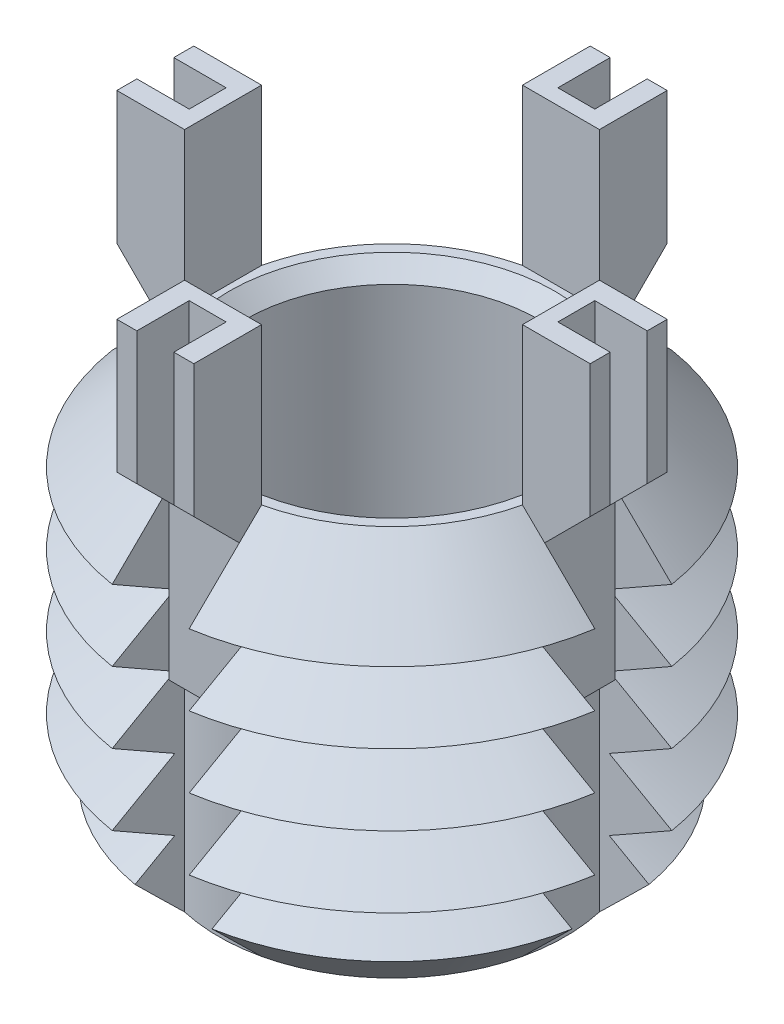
SolidWorks part; units mm, degrees
ref_plane "Front Plane" through (0, 0, 0) normal (0, 0, 1) x (1, 0, 0)
ref_plane "Top Plane" through (0, 0, 0) normal (0, 1, 0) x (1, 0, 0)
ref_plane "Right Plane" through (0, 0, 0) normal (1, 0, 0) x (0, 0, -1)
sketch "Sketch1" plane through (0, 0, 0) normal (0, 1, 0) x (1, 0, 0)
  circle A0 centre (0, 0) radius 7.9375
  dimension "D1" = 15.875
extrude "Boss-Extrude1" add sketch "Sketch1" against normal blind 12.7
chamfer "Chamfer1" distance 2.309 angle 45 2 edges at (0, -12.7, 7.9375) (0, 0, 7.9375)
sketch "Sketch2" plane through (0, 0, 0) normal (1, 0, 0) x (0, 0, -1)
  line L0 (0, 0.8859) -> (0, -9.2617) construction
sketch "Sketch3" plane through (0, 0, 0) normal (1, 0, 0) x (0, 0, -1)
  line L0 (-7.9375, -2.309) -> (-5.9378, -3.4635)
  line L1 (-5.9378, -3.4635) -> (-7.9375, -4.618)
  line L2 (-7.9375, -2.309) -> (-7.9375, -10.391) construction
  line L3 (-7.9375, -4.618) -> (-7.9375, -2.309)
  dimension "D1" = 2.309
revolve "Cut-Revolve1" cut sketch "Sketch3" angle 360 about L0
pattern_linear "LPattern1" count 4 spacing 2.309 along (0, -1, 0) of "Cut-Revolve1"
sketch "Sketch4" plane through (0, 0, 0) normal (0, 1, 0) x (1, 0, 0)
  line L0 (-5.4879, 1.25) -> (-7.8385, 1.25)
  line L2 (-7.8385, -1.25) -> (-5.4879, -1.25)
  arc A0 (-5.4879, 1.25) -> (-5.4879, -1.25) centre (0, 0) ccw
  arc A1 (-7.8385, 1.25) -> (-7.8385, -1.25) centre (0, 0) ccw
  circle A2 centre (0, 0) radius 7.9375 construction
  circle A3 centre (0, 0) radius 5.6285 construction
  point P1 (-5.6285, 0)
  point P3 (-7.9375, 0)
  point P13 (0, 0)
  dimension "D1" = 2.5
extrude "Cut-Extrude1" cut sketch "Sketch4" against normal up to surface (12.7 mm away)
pattern_circular "CirPattern1" count 4 over 360 about axis through (0, 0, 0) along (0, 1, 0) of "Cut-Extrude1"
sketch "Sketch5" plane through (0, 0, 0) normal (1, 0, 0) x (0, 0, -1)
  line L0 (-5.4879, 5.073) -> (-5.4879, -5.927)
  line L1 (-5.4879, -5.927) -> (-5.9879, -5.927)
  line L2 (-5.9879, -5.927) -> (-5.9879, -0.927)
  line L3 (-5.9879, -0.927) -> (-7.6879, 0.773)
  line L4 (-7.6879, 0.773) -> (-7.6879, 5.073)
  line L5 (-7.6879, 5.073) -> (-5.4879, 5.073)
  line L6 (-7.8385, -6.927) -> (-1.25, -6.927) construction
  point P9 (-1.25, 0)
  point P10 (-5.9879, -0.927)
  dimension "D1" = 1
  dimension "D2" = 11
  dimension "D3" = 6
  dimension "D4" = 2.2
  dimension "D5" = 0.5
  dimension "D6" = 45
extrude "Boss-Extrude3" add sketch "Sketch5" along normal mid plane 2.5
pattern_circular "CirPattern2" count 4 over 360 about axis through (0, 0, 0) along (0, 1, 0) of "Boss-Extrude3"
sketch "Sketch6" plane through (0, 5.073, 0) normal (0, 1, 0) x (1, 0, 0)
  line L0 (-7.6879, -1.25) -> (-7.6879, 1.25) construction
  line L1 (-7.6879, -0.6) -> (-5.9879, -0.6)
  line L2 (-7.6879, -0.6) -> (-7.6879, 0.6)
  line L3 (-7.6879, 0.6) -> (-5.9879, 0.6)
  line L4 (-5.9879, -0.6) -> (-5.9879, 0.6)
  line L5 (-7.6879, -0.6) -> (-5.9879, 0.6) construction
  line L6 (-7.6879, 0.6) -> (-5.9879, -0.6) construction
  line L7 (7.6879, 1.25) -> (7.6879, -1.25) construction
  line L8 (-0.6, 5.9879) -> (0.6, 5.9879)
  line L9 (-0.6, 5.9879) -> (-0.6, 7.6879)
  line L10 (-0.6, 7.6879) -> (0.6, 7.6879)
  line L11 (0.6, 5.9879) -> (0.6, 7.6879)
  line L12 (-0.6, 5.9879) -> (0.6, 7.6879) construction
  line L13 (-0.6, 7.6879) -> (0.6, 5.9879) construction
  line L14 (5.9879, -0.6) -> (7.6879, -0.6)
  line L15 (5.9879, -0.6) -> (5.9879, 0.6)
  line L16 (5.9879, 0.6) -> (7.6879, 0.6)
  line L17 (7.6879, -0.6) -> (7.6879, 0.6)
  line L18 (5.9879, -0.6) -> (7.6879, 0.6) construction
  line L19 (5.9879, 0.6) -> (7.6879, -0.6) construction
  line L20 (-0.6, -7.6879) -> (0.6, -7.6879)
  line L21 (-0.6, -7.6879) -> (-0.6, -5.9879)
  line L22 (-0.6, -5.9879) -> (0.6, -5.9879)
  line L23 (0.6, -7.6879) -> (0.6, -5.9879)
  line L24 (-0.6, -7.6879) -> (0.6, -5.9879) construction
  line L25 (-0.6, -5.9879) -> (0.6, -7.6879) construction
  line L26 (-1.25, 7.6879) -> (1.25, 7.6879) construction
  line L27 (1.25, -7.6879) -> (-1.25, -7.6879) construction
  point P0 (-6.8379, 0)
  point P7 (-7.6879, 0)
  point P8 (-7.6879, 0)
  point P9 (0, 6.8379)
  point P14 (6.8379, 0)
  point P19 (0, -6.8379)
  point P24 (0, 7.6879)
  point P25 (7.6879, 0)
  point P26 (7.6879, 0)
  point P27 (0, 7.6879)
  point P30 (0, -7.6879)
  point P33 (0, -7.6879)
  dimension "D1" = 1.2
  dimension "D2" = 1.7
extrude "Cut-Extrude3" cut sketch "Sketch6" against normal through all both and the other way through all
sketch "Sketch7" plane through (0, 0, 0) normal (0, 1, 0) x (1, 0, 0)
  circle A0 centre (0, 0) radius 4.7625
  dimension "D1" = 9.525
extrude "Cut-Extrude4" cut sketch "Sketch7" against normal up to surface (12.7 mm away)
chamfer "Chamfer2" distance 0.529 angle 45 2 edges at (0, 0, 4.7625) (0, -12.7, 4.7625)
